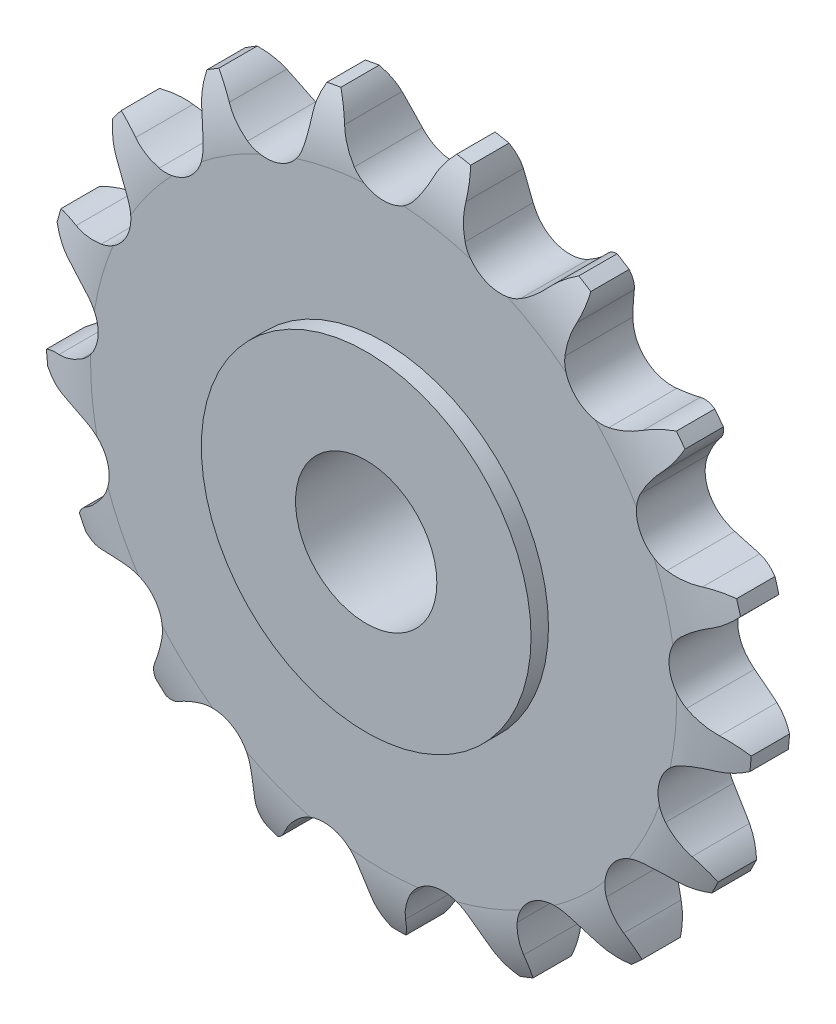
SolidWorks part; units mm, degrees
ref_plane "Front" through (0, 0, 0) normal (0, 0, 1) x (1, 0, 0)
ref_plane "Top" through (0, 0, 0) normal (0, 1, 0) x (1, 0, 0)
ref_plane "Right" through (0, 0, 0) normal (1, 0, 0) x (0, 0, -1)
sketch "ｽｹｯﾁ1" plane through (0, 0, 0) normal (1, 0, 0) x (0, 0, -1)
  line L1 (-5.5, 7.5) -> (-5.5, 17.5)
  line L3 (3.65, 17.5) -> (3.65, 31.1)
  line L5 (-5.5, 17.5) -> (-3.65, 17.5)
  line L6 (5.5, 17.5) -> (5.5, 7.5)
  line L7 (-5.5, 7.5) -> (5.5, 7.5)
  line L12 (2.0365, 37.5) -> (-2.0365, 37.5)
  line L13 (-3.65, 31.1) -> (-3.65, 17.5)
  line L14 (0, -42.5) -> (0, 0) construction
  line L15 (-10.5, 0) -> (10.5, 0) construction
  line L16 (3.65, 17.5) -> (5.5, 17.5)
  arc A10 (3.65, 31.1) -> (2.0365, 37.5) centre (-9.85, 31.1) ccw
  arc A11 (-2.0365, 37.5) -> (-3.65, 31.1) centre (9.85, 31.1) ccw
revolve "回転1" add sketch "ｽｹｯﾁ1" angle 360 about L15
sketch "ｽｹｯﾁ2" plane through (0, 0, 0) normal (0, 0, 1) x (1, 0, 0)
  arc A0 (6.1475, 36.9927) -> (-6.1475, 36.9927) centre (0, 0) ccw
  arc A1 (-4.7422, 34.76) -> (-3.151, 31.9593) centre (4.9691, 38.4252) ccw
  arc A2 (-4.7422, 34.76) -> (-6.1475, 36.9927) centre (-10.9267, 32.4258) ccw
  arc A3 (6.1475, 36.9927) -> (4.7422, 34.76) centre (10.9267, 32.4258) ccw
  arc A4 (3.151, 31.9593) -> (4.7422, 34.76) centre (-4.9691, 38.4252) ccw
  arc A5 (-3.151, 31.9593) -> (3.151, 31.9593) centre (0, 34.4684) ccw
  arc A6 (19.0957, 32.2739) -> (7.6309, 36.7154) centre (0, 0) ccw
  arc A7 (8.1348, 34.1258) -> (8.6069, 30.9395) centre (18.5143, 34.0354) ccw
  arc A8 (8.1348, 34.1258) -> (7.6309, 36.7154) centre (1.5247, 34.1833) ccw
  arc A9 (19.0957, 32.2739) -> (16.9787, 30.6996) centre (21.9024, 26.289) ccw
  arc A10 (14.4832, 28.6629) -> (16.9787, 30.6996) centre (9.2472, 37.6255) ccw
  arc A11 (8.6069, 30.9395) -> (14.4832, 28.6629) centre (12.4514, 32.1408) ccw
  arc A12 (29.4649, 23.1963) -> (20.3787, 31.4795) centre (0, 0) ccw
  arc A13 (19.9131, 28.8827) -> (19.2023, 25.741) centre (29.5591, 25.0489) ccw
  arc A14 (19.9131, 28.8827) -> (20.3787, 31.4795) centre (13.7702, 31.3242) ccw
  arc A15 (29.4649, 23.1963) -> (26.9221, 22.4931) centre (29.92, 16.6017) ccw
  arc A16 (23.8595, 21.4954) -> (26.9221, 22.4931) centre (22.2147, 31.7442) ccw
  arc A17 (19.2023, 25.741) -> (23.8595, 21.4954) centre (23.2212, 25.4725) ccw
  arc A18 (35.8547, 10.986) -> (30.3743, 21.9921) centre (0, 0) ccw
  arc A19 (29.0021, 19.7389) -> (27.2043, 17.0661) centre (36.6117, 12.6794) ccw
  arc A20 (29.0021, 19.7389) -> (30.3743, 21.9921) centre (24.1559, 24.2346) ccw
  arc A21 (35.8547, 10.986) -> (33.2296, 11.2488) centre (33.8968, 4.6722) ccw
  arc A22 (30.0133, 11.4249) -> (33.2296, 11.2488) centre (32.1819, 21.5757) ccw
  arc A23 (27.2043, 17.0661) -> (30.0133, 11.4249) centre (30.8548, 15.3639) ccw
  arc A24 (37.4021, -2.7081) -> (36.2676, 9.5346) centre (0, 0) ccw
  arc A25 (34.1741, 7.9292) -> (31.5323, 6.0864) centre (38.7198, -1.4025) ccw
  arc A26 (34.1741, 7.9292) -> (36.2676, 9.5346) centre (31.2793, 13.872) ccw
  arc A27 (37.4021, -2.7081) -> (35.0492, -1.5147) centre (33.2957, -7.8882) ccw
  arc A28 (32.1137, -0.1887) -> (35.0492, -1.5147) centre (37.8028, 8.4933) ccw
  arc A29 (31.5323, 6.0864) -> (32.1137, -0.1887) centre (34.3214, 3.1803) ccw
  arc A30 (33.8981, -16.0364) -> (37.2629, -4.2107) centre (0, 0) ccw
  arc A31 (34.7308, -4.9514) -> (31.6016, -5.7154) centre (35.5985, -15.295) ccw
  arc A32 (34.7308, -4.9514) -> (37.2629, -4.2107) centre (34.1782, 1.6358) ccw
  arc A33 (33.8981, -16.0364) -> (32.1353, -14.0737) centre (28.1977, -19.3833) ccw
  arc A34 (29.877, -11.7768) -> (32.1353, -14.0737) centre (38.3182, -5.7361) ccw
  arc A35 (31.6016, -5.7154) -> (29.877, -11.7768) centre (33.1526, -9.4327) ccw
  arc A36 (25.8161, -27.1989) -> (33.2255, -17.3872) centre (0, 0) ccw
  arc A37 (30.5969, -17.1632) -> (27.403, -16.7453) centre (27.6694, -27.1218) ccw
  arc A38 (30.5969, -17.1632) -> (33.2255, -17.3872) centre (32.4612, -10.8212) ccw
  arc A39 (25.8161, -27.1989) -> (24.8813, -24.7319) centre (19.2915, -28.2606) ccw
  arc A40 (23.6052, -21.7743) -> (24.8813, -24.7319) centre (33.6585, -19.1909) ccw
  arc A41 (27.403, -16.7453) -> (23.6052, -21.7743) centre (27.5064, -20.7719) ccw
  arc A42 (14.2474, -34.6881) -> (24.7009, -28.2155) centre (0, 0) ccw
  arc A43 (22.3306, -27.0571) -> (19.5034, -25.5136) centre (16.0034, -35.2857) ccw
  arc A44 (22.3306, -27.0571) -> (24.7009, -28.2155) centre (26.3601, -21.8168) ccw
  arc A45 (14.2474, -34.6881) -> (14.2669, -32.05) centre (7.7799, -33.3211) ccw
  arc A46 (14.1454, -28.8312) -> (14.2669, -32.05) centre (24.4531, -30.0539) ccw
  arc A47 (19.5034, -25.5136) -> (14.1454, -28.8312) centre (18.1453, -29.3056) ccw
  arc A48 (0.7545, -37.4924) -> (12.8403, -35.2332) centre (0, 0) ccw
  arc A49 (11.0486, -33.2967) -> (8.9698, -30.8362) centre (2.1761, -38.684) ccw
  arc A50 (11.0486, -33.2967) -> (12.8403, -35.2332) centre (16.6989, -29.8659) ccw
  arc A51 (0.7545, -37.4924) -> (1.7257, -35.0395) centre (-4.7824, -33.8815) ccw
  arc A52 (2.7752, -31.9942) -> (1.7257, -35.0395) centre (11.9451, -36.8579) ccw
  arc A53 (8.9698, -30.8362) -> (2.7752, -31.9942) centre (6.3336, -33.8815) ccw
  arc A54 (-12.8403, -35.2332) -> (-0.7545, -37.4924) centre (0, 0) ccw
  arc A55 (-1.7257, -35.0395) -> (-2.7752, -31.9942) centre (-11.9451, -36.8579) ccw
  arc A56 (-1.7257, -35.0395) -> (-0.7545, -37.4924) centre (4.7824, -33.8815) ccw
  arc A57 (-12.8403, -35.2332) -> (-11.0486, -33.2967) centre (-16.6989, -29.8659) ccw
  arc A58 (-8.9698, -30.8362) -> (-11.0486, -33.2967) centre (-2.1761, -38.684) ccw
  arc A59 (-2.7752, -31.9942) -> (-8.9698, -30.8362) centre (-6.3336, -33.8815) ccw
  arc A60 (-24.7009, -28.2155) -> (-14.2474, -34.6881) centre (0, 0) ccw
  arc A61 (-14.2669, -32.05) -> (-14.1454, -28.8312) centre (-24.4531, -30.0539) ccw
  arc A62 (-14.2669, -32.05) -> (-14.2474, -34.6881) centre (-7.7799, -33.3211) ccw
  arc A63 (-24.7009, -28.2155) -> (-22.3306, -27.0571) centre (-26.3601, -21.8168) ccw
  arc A64 (-19.5034, -25.5136) -> (-22.3306, -27.0571) centre (-16.0034, -35.2857) ccw
  arc A65 (-14.1454, -28.8312) -> (-19.5034, -25.5136) centre (-18.1453, -29.3056) ccw
  arc A66 (-33.2255, -17.3872) -> (-25.8161, -27.1989) centre (0, 0) ccw
  arc A67 (-24.8813, -24.7319) -> (-23.6052, -21.7743) centre (-33.6585, -19.1909) ccw
  arc A68 (-24.8813, -24.7319) -> (-25.8161, -27.1989) centre (-19.2915, -28.2606) ccw
  arc A69 (-33.2255, -17.3872) -> (-30.5969, -17.1632) centre (-32.4612, -10.8212) ccw
  arc A70 (-27.403, -16.7453) -> (-30.5969, -17.1632) centre (-27.6694, -27.1218) ccw
  arc A71 (-23.6052, -21.7743) -> (-27.403, -16.7453) centre (-27.5064, -20.7719) ccw
  arc A72 (-37.2629, -4.2107) -> (-33.8981, -16.0364) centre (0, 0) ccw
  arc A73 (-32.1353, -14.0737) -> (-29.877, -11.7768) centre (-38.3182, -5.7361) ccw
  arc A74 (-32.1353, -14.0737) -> (-33.8981, -16.0364) centre (-28.1977, -19.3833) ccw
  arc A75 (-37.2629, -4.2107) -> (-34.7308, -4.9514) centre (-34.1782, 1.6358) ccw
  arc A76 (-31.6016, -5.7154) -> (-34.7308, -4.9514) centre (-35.5985, -15.295) ccw
  arc A77 (-29.877, -11.7768) -> (-31.6016, -5.7154) centre (-33.1526, -9.4327) ccw
  arc A78 (-36.2676, 9.5346) -> (-37.4021, -2.7081) centre (0, 0) ccw
  arc A79 (-35.0492, -1.5147) -> (-32.1137, -0.1887) centre (-37.8028, 8.4933) ccw
  arc A80 (-35.0492, -1.5147) -> (-37.4021, -2.7081) centre (-33.2957, -7.8882) ccw
  arc A81 (-36.2676, 9.5346) -> (-34.1741, 7.9292) centre (-31.2793, 13.872) ccw
  arc A82 (-31.5323, 6.0864) -> (-34.1741, 7.9292) centre (-38.7198, -1.4025) ccw
  arc A83 (-32.1137, -0.1887) -> (-31.5323, 6.0864) centre (-34.3214, 3.1803) ccw
  arc A84 (-30.3743, 21.9921) -> (-35.8547, 10.986) centre (0, 0) ccw
  arc A85 (-33.2296, 11.2488) -> (-30.0133, 11.4249) centre (-32.1819, 21.5757) ccw
  arc A86 (-33.2296, 11.2488) -> (-35.8547, 10.986) centre (-33.8968, 4.6722) ccw
  arc A87 (-30.3743, 21.9921) -> (-29.0021, 19.7389) centre (-24.1559, 24.2346) ccw
  arc A88 (-27.2043, 17.0661) -> (-29.0021, 19.7389) centre (-36.6117, 12.6794) ccw
  arc A89 (-30.0133, 11.4249) -> (-27.2043, 17.0661) centre (-30.8548, 15.3639) ccw
  arc A90 (-20.3787, 31.4795) -> (-29.4649, 23.1963) centre (0, 0) ccw
  arc A91 (-26.9221, 22.4931) -> (-23.8595, 21.4954) centre (-22.2147, 31.7442) ccw
  arc A92 (-26.9221, 22.4931) -> (-29.4649, 23.1963) centre (-29.92, 16.6017) ccw
  arc A93 (-20.3787, 31.4795) -> (-19.9131, 28.8827) centre (-13.7702, 31.3242) ccw
  arc A94 (-19.2023, 25.741) -> (-19.9131, 28.8827) centre (-29.5591, 25.0489) ccw
  arc A95 (-23.8595, 21.4954) -> (-19.2023, 25.741) centre (-23.2212, 25.4725) ccw
  arc A99 (-14.4832, 28.6629) -> (-8.6069, 30.9395) centre (-12.4514, 32.1408) ccw
  arc A100 (-8.6069, 30.9395) -> (-8.1348, 34.1258) centre (-18.5143, 34.0354) ccw
  arc A101 (-7.6309, 36.7154) -> (-8.1348, 34.1258) centre (-1.5247, 34.1833) ccw
  arc A102 (-16.9787, 30.6996) -> (-19.0957, 32.2739) centre (-21.9024, 26.289) ccw
  arc A103 (-16.9787, 30.6996) -> (-14.4832, 28.6629) centre (-9.2472, 37.6255) ccw
  arc A104 (-7.6309, 36.7154) -> (-19.0957, 32.2739) centre (0, 0) ccw
extrude "ｶｯﾄ - 押し出し1" cut sketch "ｽｹｯﾁ2" against normal through all both and the other way through all
